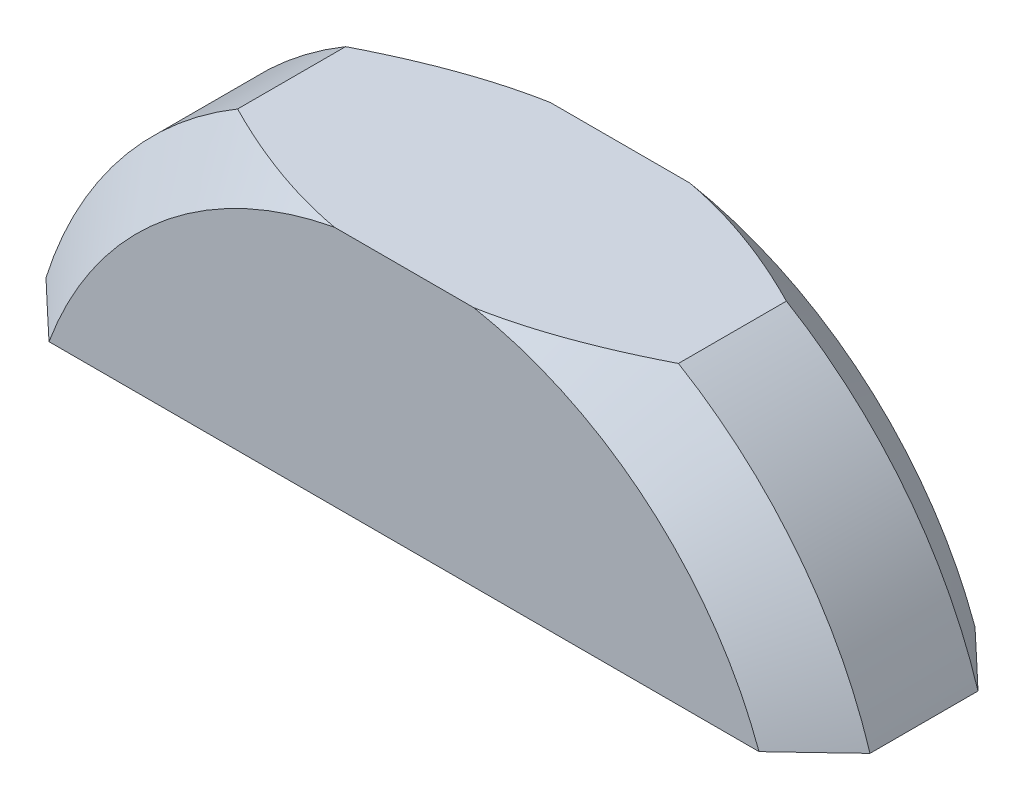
SolidWorks part; units mm, degrees
ref_plane "front" through (0, 0, 0) normal (0, 0, 1) x (1, 0, 0)
ref_plane "top" through (0, 0, 0) normal (0, 1, 0) x (1, 0, 0)
ref_plane "right" through (0, 0, 0) normal (1, 0, 0) x (0, 0, -1)
sketch "body" plane through (0, 0, 0) normal (0, 0, 1) x (1, 0, 0)
  line L0 (-1.9079, 0.6) -> (1.9079, 0.6)
  line L1 (-1.0206, 1.72) -> (1.0206, 1.72)
  arc A0 (-1.9079, 0.6) -> (-1.0206, 1.72) centre (0, 0) cw
  arc A1 (1.0206, 1.72) -> (1.9079, 0.6) centre (0, 0) cw
  dimension "Diameter" = 4
  dimension "Height" = 1.4
  dimension "Height2" = 1.12
extrude "Extrude1" add sketch "body" along normal blind 1
chamfer "Chamfer1" distance 0.25 6 edges at (-1.5677, 1.2419, 0) (0, 1.72, 0) (1.5677, 1.2419, 0) (1.5677, 1.2419, 1) (0, 1.72, 1) (-1.5677, 1.2419, 1)
equation "\"Height2@body\" = \"Height@body\" * 4 / 5"
